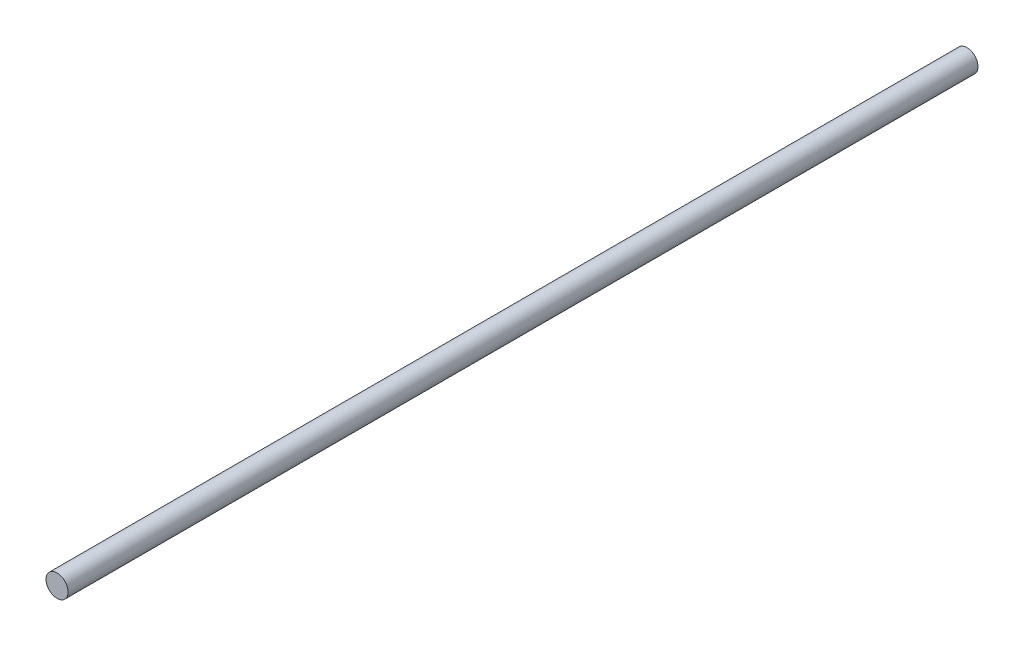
SolidWorks part; units mm, degrees
ref_plane "Front Plane" through (0, 0, 0) normal (0, 0, 1) x (1, 0, 0)
ref_plane "Top Plane" through (0, 0, 0) normal (0, 1, 0) x (1, 0, 0)
ref_plane "Right Plane" through (0, 0, 0) normal (1, 0, 0) x (0, 0, -1)
sketch "Sketch1" plane through (0, 0, 0) normal (0, 0, 1) x (1, 0, 0)
  circle A0 centre (0, 0) radius 15
  dimension "D1" = 30
extrude "Boss-Extrude1" add sketch "Sketch1" along normal blind 1236
